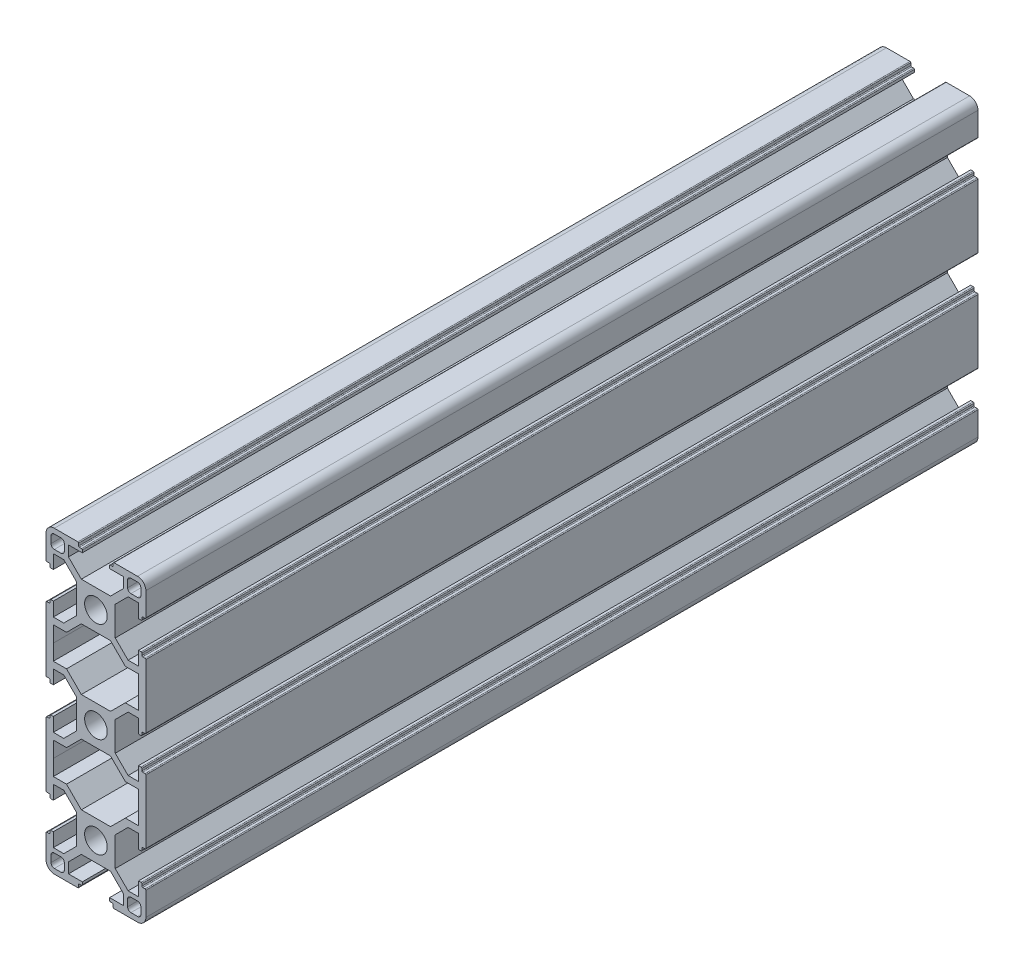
SolidWorks part; units mm, degrees
ref_plane "Front Plane" through (0, 0, 0) normal (0, 0, 1) x (1, 0, 0)
ref_plane "Top Plane" through (0, 0, 0) normal (0, 1, 0) x (1, 0, 0)
ref_plane "Right Plane" through (0, 0, 0) normal (1, 0, 0) x (0, 0, -1)
sketch "Sketch1" plane through (0, 0, 0) normal (0, 0, 1) x (1, 0, 0)
  line L0 (0, -5.8) -> (0, 5.8) construction
  line L1 (0, 0) -> (-15, 15) construction
  line L2 (-15, 15) -> (-5.2, 15)
  line L3 (-5.2, 15) -> (-5.2, 13.8083)
  line L4 (-5.2, 13.8083) -> (-4.1, 13.8083)
  line L5 (-4.1, 13.8083) -> (-4.1, 12.8)
  line L6 (-4.1, 12.8) -> (-8.25, 12.8)
  line L7 (-8.25, 12.8) -> (-8.25, 9.6642)
  line L8 (-8.25, 9.6642) -> (-4.3858, 5.8)
  line L9 (-4.3858, 5.8) -> (4.3858, 5.8)
  line L10 (-5.8, 4.3858) -> (-5.8, -4.3858)
  line L11 (-9.6642, 8.25) -> (-5.8, 4.3858)
  line L12 (-12.8, 8.25) -> (-9.6642, 8.25)
  line L13 (-12.8, 4.1) -> (-12.8, 8.25)
  line L14 (-13.8083, 4.1) -> (-12.8, 4.1)
  line L15 (-13.8083, 5.2) -> (-13.8083, 4.1)
  line L16 (-15, 5.2) -> (-13.8083, 5.2)
  line L17 (-15, 15) -> (-15, 5.2)
  line L18 (0, 0) -> (15, 15) construction
  line L19 (15, 15) -> (15, 5.2)
  line L20 (15, 5.2) -> (13.8083, 5.2)
  line L21 (13.8083, 5.2) -> (13.8083, 4.1)
  line L22 (13.8083, 4.1) -> (12.8, 4.1)
  line L23 (12.8, 4.1) -> (12.8, 8.25)
  line L24 (12.8, 8.25) -> (9.6642, 8.25)
  line L25 (9.6642, 8.25) -> (5.8, 4.3858)
  line L26 (5.8, 4.3858) -> (5.8, -4.3858)
  line L27 (8.25, 9.6642) -> (4.3858, 5.8)
  line L28 (8.25, 12.8) -> (8.25, 9.6642)
  line L29 (4.1, 12.8) -> (8.25, 12.8)
  line L30 (4.1, 13.8083) -> (4.1, 12.8)
  line L31 (5.2, 13.8083) -> (4.1, 13.8083)
  line L32 (5.2, 15) -> (5.2, 13.8083)
  line L33 (15, 15) -> (5.2, 15)
  line L34 (0, 0) -> (3.5826, 0) construction
  line L35 (0, 0) -> (15, -15) construction
  line L36 (0, 0) -> (-15, -15) construction
  line L37 (-4.3858, -5.8) -> (-8.8358, -10.25)
  line L38 (-8.8358, -10.25) -> (-12.8, -10.25)
  line L39 (-12.8, -10.25) -> (-12.7618, -15)
  line L40 (-12.8, -19.75) -> (-12.7618, -15)
  line L41 (-8.8358, -19.75) -> (-12.8, -19.75)
  line L42 (-4.3858, -24.2) -> (-8.8358, -19.75)
  line L43 (4.3858, -5.8) -> (8.8358, -10.25)
  line L44 (9.6642, -8.25) -> (5.8, -4.3858)
  line L45 (12.8, -8.25) -> (9.6642, -8.25)
  line L46 (12.8, -4.1) -> (12.8, -8.25)
  line L47 (13.8083, -4.1) -> (12.8, -4.1)
  line L48 (13.8083, -5.2) -> (13.8083, -4.1)
  line L49 (15, -5.2) -> (13.8083, -5.2)
  line L50 (15, -24.8) -> (15, -5.2)
  line L51 (-15, -24.8) -> (-15, -5.2)
  line L52 (-15, -5.2) -> (-13.8083, -5.2)
  line L53 (-13.8083, -5.2) -> (-13.8083, -4.1)
  line L54 (-13.8083, -4.1) -> (-12.8, -4.1)
  line L55 (-12.8, -4.1) -> (-12.8, -8.25)
  line L56 (-12.8, -8.25) -> (-9.6642, -8.25)
  line L57 (-9.6642, -8.25) -> (-5.8, -4.3858)
  line L58 (-4.3858, -5.8) -> (4.3858, -5.8)
  line L59 (8.8358, -10.25) -> (12.8, -10.25)
  line L60 (12.8, -10.25) -> (12.7618, -15)
  line L61 (12.8, -19.75) -> (12.7618, -15)
  line L62 (8.8358, -19.75) -> (12.8, -19.75)
  line L63 (4.3858, -24.2) -> (8.8358, -19.75)
  line L64 (0, -30) -> (15, -45) construction
  line L65 (0, -30) -> (-15, -45) construction
  line L66 (0, -5.8) -> (0, -24.2) construction
  line L67 (0, -15) -> (-25.5237, -15) construction
  line L68 (0, -30) -> (-15, -15) construction
  line L69 (0, -30) -> (15, -15) construction
  line L70 (0, -30) -> (3.5826, -30) construction
  line L71 (0, -54.2) -> (0, -35.8) construction
  line L72 (9.6642, -38.25) -> (5.8, -34.3858)
  line L73 (12.8, -38.25) -> (9.6642, -38.25)
  line L74 (12.8, -34.1) -> (12.8, -38.25)
  line L75 (13.8083, -34.1) -> (12.8, -34.1)
  line L76 (13.8083, -35.2) -> (13.8083, -34.1)
  line L77 (15, -35.2) -> (13.8083, -35.2)
  line L78 (-15, -35.2) -> (-13.8083, -35.2)
  line L79 (-4.3858, -24.2) -> (4.3858, -24.2)
  line L80 (-9.6642, -21.75) -> (-5.8, -25.6142)
  line L81 (-12.8, -21.75) -> (-9.6642, -21.75)
  line L82 (-12.8, -25.9) -> (-12.8, -21.75)
  line L83 (-13.8083, -25.9) -> (-12.8, -25.9)
  line L84 (-13.8083, -24.8) -> (-13.8083, -25.9)
  line L85 (-15, -24.8) -> (-13.8083, -24.8)
  line L86 (15, -24.8) -> (13.8083, -24.8)
  line L87 (13.8083, -24.8) -> (13.8083, -25.9)
  line L88 (13.8083, -25.9) -> (12.8, -25.9)
  line L89 (12.8, -25.9) -> (12.8, -21.75)
  line L90 (12.8, -21.75) -> (9.6642, -21.75)
  line L91 (9.6642, -21.75) -> (5.8, -25.6142)
  line L92 (-13.8083, -35.2) -> (-13.8083, -34.1)
  line L93 (-13.8083, -34.1) -> (-12.8, -34.1)
  line L94 (-12.8, -34.1) -> (-12.8, -38.25)
  line L95 (-12.8, -38.25) -> (-9.6642, -38.25)
  line L96 (-9.6642, -38.25) -> (-5.8, -34.3858)
  line L97 (-4.3858, -35.8) -> (4.3858, -35.8)
  line L98 (4.3858, -35.8) -> (8.8358, -40.25)
  line L99 (8.8358, -40.25) -> (12.8, -40.25)
  line L100 (12.8, -40.25) -> (12.7618, -45)
  line L101 (15, -35.2) -> (15, -54.8)
  line L102 (-15, -35.2) -> (-15, -54.8)
  line L103 (-4.3858, -35.8) -> (-8.8358, -40.25)
  line L104 (-8.8358, -40.25) -> (-12.8, -40.25)
  line L105 (-12.8, -40.25) -> (-12.7618, -45)
  line L106 (0, -60) -> (3.5826, -60) construction
  line L107 (0, -60) -> (15, -75) construction
  line L108 (0, -60) -> (-15, -75) construction
  line L109 (0, -54.2) -> (0, -65.8) construction
  line L110 (8.8358, -49.75) -> (12.8, -49.75)
  line L111 (-4.3858, -54.2) -> (4.3858, -54.2)
  line L112 (-9.6642, -51.75) -> (-5.8, -55.6142)
  line L113 (-12.8, -51.75) -> (-9.6642, -51.75)
  line L114 (-12.8, -55.9) -> (-12.8, -51.75)
  line L115 (-13.8083, -55.9) -> (-12.8, -55.9)
  line L116 (-13.8083, -54.8) -> (-13.8083, -55.9)
  line L117 (-15, -54.8) -> (-13.8083, -54.8)
  line L118 (15, -54.8) -> (13.8083, -54.8)
  line L119 (13.8083, -54.8) -> (13.8083, -55.9)
  line L120 (13.8083, -55.9) -> (12.8, -55.9)
  line L121 (12.8, -55.9) -> (12.8, -51.75)
  line L122 (12.8, -51.75) -> (9.6642, -51.75)
  line L123 (9.6642, -51.75) -> (5.8, -55.6142)
  line L124 (4.3858, -54.2) -> (8.8358, -49.75)
  line L125 (-8.8358, -49.75) -> (-12.8, -49.75)
  line L126 (-4.3858, -54.2) -> (-8.8358, -49.75)
  line L127 (15, -75) -> (5.2, -75)
  line L128 (5.2, -75) -> (5.2, -73.8083)
  line L129 (5.2, -73.8083) -> (4.1, -73.8083)
  line L130 (4.1, -73.8083) -> (4.1, -72.8)
  line L131 (4.1, -72.8) -> (8.25, -72.8)
  line L132 (8.25, -72.8) -> (8.25, -69.6642)
  line L133 (8.25, -69.6642) -> (4.3858, -65.8)
  line L134 (5.8, -64.3858) -> (5.8, -55.6142)
  line L135 (9.6642, -68.25) -> (5.8, -64.3858)
  line L136 (12.8, -68.25) -> (9.6642, -68.25)
  line L137 (12.8, -64.1) -> (12.8, -68.25)
  line L138 (13.8083, -64.1) -> (12.8, -64.1)
  line L139 (13.8083, -65.2) -> (13.8083, -64.1)
  line L140 (15, -65.2) -> (13.8083, -65.2)
  line L141 (15, -75) -> (15, -65.2)
  line L142 (-15, -75) -> (-15, -65.2)
  line L143 (-15, -65.2) -> (-13.8083, -65.2)
  line L144 (-13.8083, -65.2) -> (-13.8083, -64.1)
  line L145 (-13.8083, -64.1) -> (-12.8, -64.1)
  line L146 (-12.8, -64.1) -> (-12.8, -68.25)
  line L147 (-12.8, -68.25) -> (-9.6642, -68.25)
  line L148 (-9.6642, -68.25) -> (-5.8, -64.3858)
  line L149 (-5.8, -64.3858) -> (-5.8, -55.6142)
  line L150 (-4.3858, -65.8) -> (4.3858, -65.8)
  line L151 (-8.25, -69.6642) -> (-4.3858, -65.8)
  line L152 (-8.25, -72.8) -> (-8.25, -69.6642)
  line L153 (-4.1, -72.8) -> (-8.25, -72.8)
  line L154 (-4.1, -73.8083) -> (-4.1, -72.8)
  line L155 (-5.2, -73.8083) -> (-4.1, -73.8083)
  line L156 (-5.2, -75) -> (-5.2, -73.8083)
  line L157 (-15, -75) -> (-5.2, -75)
  line L158 (-5.8, -25.6142) -> (-5.8, -34.3858)
  line L159 (5.8, -25.6142) -> (5.8, -34.3858)
  line L160 (12.7618, -45) -> (12.8, -49.75)
  line L161 (-12.7618, -45) -> (-12.8, -49.75)
  point P30 (0, 5.8)
  point P48 (5.8, 0)
  point P61 (-5.8, 0)
  point P130 (-5.8, -30)
  point P131 (5.8, -30)
  point P168 (-5.8, -60)
  point P169 (5.8, -60)
  dimension "D1" = 2
  dimension "D2" = 15
  dimension "D3" = 1
  dimension "D4" = 4.1
  dimension "D5" = 5.2
  dimension "D6" = 2.2
  dimension "D7" = 8.25
  dimension "D8" = 9.2
extrude "Boss-Extrude1" add sketch "Sketch1" along normal blind 250
sketch "Sketch2" plane through (0, 0, 250) normal (0, 0, 1) x (1, 0, 0)
  line L0 (0, 0) -> (0, 17.0054) construction
  line L1 (0, 0) -> (20.7717, 0) construction
  line L2 (-5.2, 15) -> (-15, 15) construction
  line L3 (-12.5, 13.5) -> (-10.5, 13.5)
  line L4 (-13.5, 12.5) -> (-13.5, 10.5)
  line L5 (-12.5, 9.5) -> (-10.5, 9.5)
  line L6 (-9.5, 12.5) -> (-9.5, 10.5)
  line L7 (-13.5, 13.5) -> (-9.5, 9.5) construction
  line L8 (-13.5, 9.5) -> (-9.5, 13.5) construction
  line L9 (-15, 15) -> (-15, 5.2) construction
  line L10 (13.5, 9.5) -> (9.5, 13.5) construction
  line L11 (13.5, 13.5) -> (9.5, 9.5) construction
  line L12 (9.5, 12.5) -> (9.5, 10.5)
  line L13 (12.5, 9.5) -> (10.5, 9.5)
  line L14 (13.5, 12.5) -> (13.5, 10.5)
  line L15 (12.5, 13.5) -> (10.5, 13.5)
  line L16 (-12.7618, -45) -> (12.7618, -45) construction
  line L17 (13.5, -73.5) -> (9.5, -69.5) construction
  line L18 (13.5, -69.5) -> (9.5, -73.5) construction
  line L19 (-13.5, -69.5) -> (-9.5, -73.5) construction
  line L20 (0, -30) -> (20.7717, -30) construction
  line L21 (-13.5, -73.5) -> (-9.5, -69.5) construction
  line L22 (0, -60) -> (20.7717, -60) construction
  line L23 (0, -60) -> (0, -77.0054) construction
  line L24 (12.5, -73.5) -> (10.5, -73.5)
  line L25 (13.5, -72.5) -> (13.5, -70.5)
  line L26 (12.5, -69.5) -> (10.5, -69.5)
  line L27 (9.5, -72.5) -> (9.5, -70.5)
  line L28 (-12.7618, -15) -> (12.7618, -15) construction
  line L29 (-9.5, -72.5) -> (-9.5, -70.5)
  line L30 (-12.5, -69.5) -> (-10.5, -69.5)
  line L31 (-13.5, -72.5) -> (-13.5, -70.5)
  line L32 (-12.5, -73.5) -> (-10.5, -73.5)
  arc A0 (-12.5, 13.5) -> (-13.5, 12.5) centre (-12.5, 12.5) ccw
  arc A1 (-13.5, 10.5) -> (-12.5, 9.5) centre (-12.5, 10.5) ccw
  arc A2 (-10.5, 9.5) -> (-9.5, 10.5) centre (-10.5, 10.5) ccw
  arc A3 (-10.5, 13.5) -> (-9.5, 12.5) centre (-10.5, 12.5) cw
  arc A4 (10.5, 13.5) -> (9.5, 12.5) centre (10.5, 12.5) ccw
  arc A5 (10.5, 9.5) -> (9.5, 10.5) centre (10.5, 10.5) cw
  arc A6 (13.5, 10.5) -> (12.5, 9.5) centre (12.5, 10.5) cw
  arc A7 (12.5, 13.5) -> (13.5, 12.5) centre (12.5, 12.5) cw
  circle A8 centre (0, -30) radius 3.4
  circle A9 centre (0, -60) radius 3.4
  arc A10 (12.5, -73.5) -> (13.5, -72.5) centre (12.5, -72.5) ccw
  arc A11 (13.5, -70.5) -> (12.5, -69.5) centre (12.5, -70.5) ccw
  arc A12 (10.5, -69.5) -> (9.5, -70.5) centre (10.5, -70.5) ccw
  arc A13 (10.5, -73.5) -> (9.5, -72.5) centre (10.5, -72.5) cw
  arc A14 (-10.5, -73.5) -> (-9.5, -72.5) centre (-10.5, -72.5) ccw
  arc A15 (-10.5, -69.5) -> (-9.5, -70.5) centre (-10.5, -70.5) cw
  circle A16 centre (0, 0) radius 3.4
  arc A17 (-13.5, -70.5) -> (-12.5, -69.5) centre (-12.5, -70.5) cw
  arc A18 (-12.5, -73.5) -> (-13.5, -72.5) centre (-12.5, -72.5) cw
  point P3 (-11.5, 11.5)
  point P41 (11.5, 11.5)
  point P88 (11.5, -71.5)
  point P89 (-11.5, -71.5)
  dimension "D5" = 1
  dimension "D6" = 6.8
  dimension "D1" = 1.5
  dimension "D2" = 1.5
  dimension "D3" = 4
  dimension "D4" = 4
extrude "Cut-Extrude1" cut sketch "Sketch2" against normal through all
fillet "Fillet1" radius 2.5 4 edges at (15, 15, 125) (-15, 15, 125) (-15, -75, 125) (15, -75, 125)
fillet "Fillet2" radius 0.25 48 edges at (-13.8083, 5.2, 125) (-13.8083, 4.1, 125) (-15, 5.2, 125) (-13.8083, -4.1, 125) (-13.8083, -5.2, 125) (-15, -5.2, 125) (13.8083, -5.2, 125) (13.8083, -4.1, 125) (15, -5.2, 125) (13.8083, 4.1, 125) (13.8083, 5.2, 125) (15, 5.2, 125) (-4.1, 13.8083, 125) (-5.2, 13.8083, 125) (4.1, 13.8083, 125) (5.2, 13.8083, 125) (5.2, 15, 125) (-5.2, 15, 125) (13.8083, -25.9, 125) (13.8083, -24.8, 125) (15, -24.8, 125) (-13.8083, -25.9, 125) (-13.8083, -24.8, 125) (-15, -24.8, 125) (-5.2, -75, 125) (-5.2, -73.8083, 125) (-4.1, -73.8083, 125) (5.2, -73.8083, 125) (5.2, -75, 125) (4.1, -73.8083, 125) (-13.8083, -65.2, 125) (-13.8083, -64.1, 125) (-15, -65.2, 125) (-13.8083, -55.9, 125) (-13.8083, -54.8, 125) (-15, -54.8, 125) (13.8083, -54.8, 125) (13.8083, -55.9, 125) (15, -54.8, 125) (15, -65.2, 125) (13.8083, -65.2, 125) (13.8083, -64.1, 125) (13.8083, -35.2, 125) (15, -35.2, 125) (13.8083, -34.1, 125) (-13.8083, -35.2, 125) (-15, -35.2, 125) (-13.8083, -34.1, 125)
